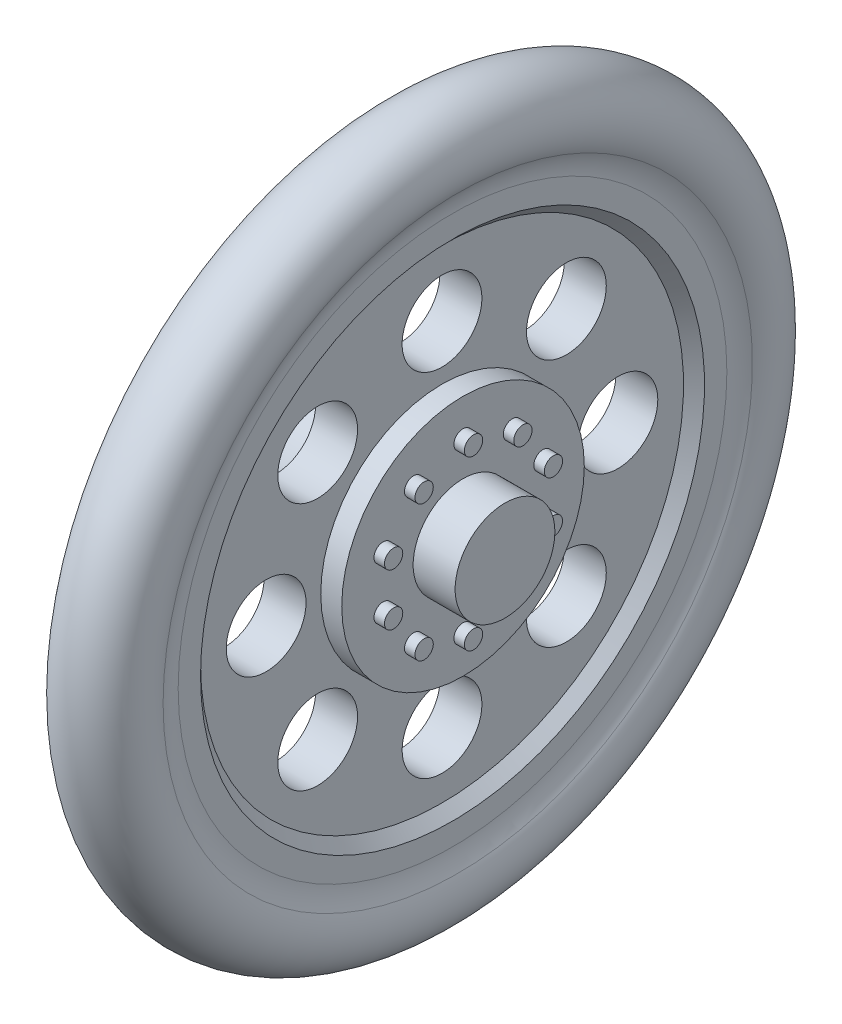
SolidWorks part; units mm, degrees
ref_plane "Front Plane" through (0, 0, 0) normal (0, 0, 1) x (1, 0, 0)
ref_plane "Top Plane" through (0, 0, 0) normal (0, 1, 0) x (1, 0, 0)
ref_plane "Right Plane" through (0, 0, 0) normal (1, 0, 0) x (0, 0, -1)
sketch "Sketch1" plane through (0, 0, 0) normal (0, 0, 1) x (1, 0, 0)
  line L0 (0, 0) -> (17.1706, 0) construction
  line L1 (9.5, 0) -> (0, 0)
  line L2 (0, 0) -> (0, 3.1)
  line L3 (0, 3.1) -> (7.5, 3.1)
  line L4 (7.5, 3.1) -> (7.5, 11.5)
  line L5 (7.5, 7.7069) -> (9.5, 7.7069) construction
  line L6 (9.5, 11.5) -> (9.5, 0)
  line L7 (8.5, 7.7069) -> (8.5, 15) construction
  line L8 (10, 12) -> (9.5, 11.5)
  line L9 (7, 13.6771) -> (7, 12)
  line L10 (7, 12) -> (7.5, 11.5)
  line L11 (10, 13.6771) -> (10, 12)
  arc A0 (10, 13.6771) -> (7, 13.6771) centre (8.5, 15) ccw
  dimension "D1" = 4
  dimension "D3" = 34
  dimension "D5" = 6.5
  dimension "D2" = 2
  dimension "D4" = 6.2
  dimension "D6" = 23
  dimension "D7" = 0.5
  dimension "D8" = 45
revolve "Revolve1" add sketch "Sketch1" angle 360 about L0
fillet "Fillet1" radius 2 2 edges at (7, 0, 13.6771) (10, 0, 13.6771)
sketch "Sketch2" plane through (9.5, 0, 0) normal (1, 0, 0) x (0, 0, -1)
  circle A0 centre (0, 0) radius 5.775
  dimension "D1" = 11.55
extrude "Extrude1" add sketch "Sketch2" along normal blind 1
sketch "Sketch3" plane through (10.5, 0, 0) normal (1, 0, 0) x (0, 0, -1)
  circle A0 centre (0, 0) radius 2.375
  dimension "D1" = 4.75
extrude "Extrude2" add sketch "Sketch3" along normal blind 2
sketch "Sketch4" plane through (10.5, 0, 0) normal (1, 0, 0) x (0, 0, -1)
  circle A0 centre (0, 0) radius 4 construction
  circle A1 centre (0, 4) radius 0.435
  dimension "D1" = 0.87
  dimension "D2" = 8
extrude "Extrude3" add sketch "Sketch4" along normal blind 0.5
pattern_circular "CirPattern1" count 10 over 360 about axis through (0, 0, 0) along (1, 0, 0) of "Extrude3"
sketch "Sketch5" plane through (9.5, 0, 0) normal (1, 0, 0) x (0, 0, -1)
  circle A0 centre (0, 0) radius 8.375 construction
  circle A1 centre (0, 8.375) radius 1.9
  dimension "D1" = 3.8
  dimension "D2" = 16.75
extrude "Cut-Extrude1" cut sketch "Sketch5" against normal through all
pattern_circular "CirPattern2" count 8 over 360 about axis through (0, 0, 0) along (1, 0, 0) of "Cut-Extrude1"
sketch "Sketch6" plane through (0, 0, 0) normal (-1, 0, 0) x (0, 0, 1)
  circle A0 centre (0, 0) radius 1.63
  dimension "D1" = 3.26
extrude "Cut-Extrude2" cut sketch "Sketch6" against normal offset from surface (10.9125 mm away) 1.5875
